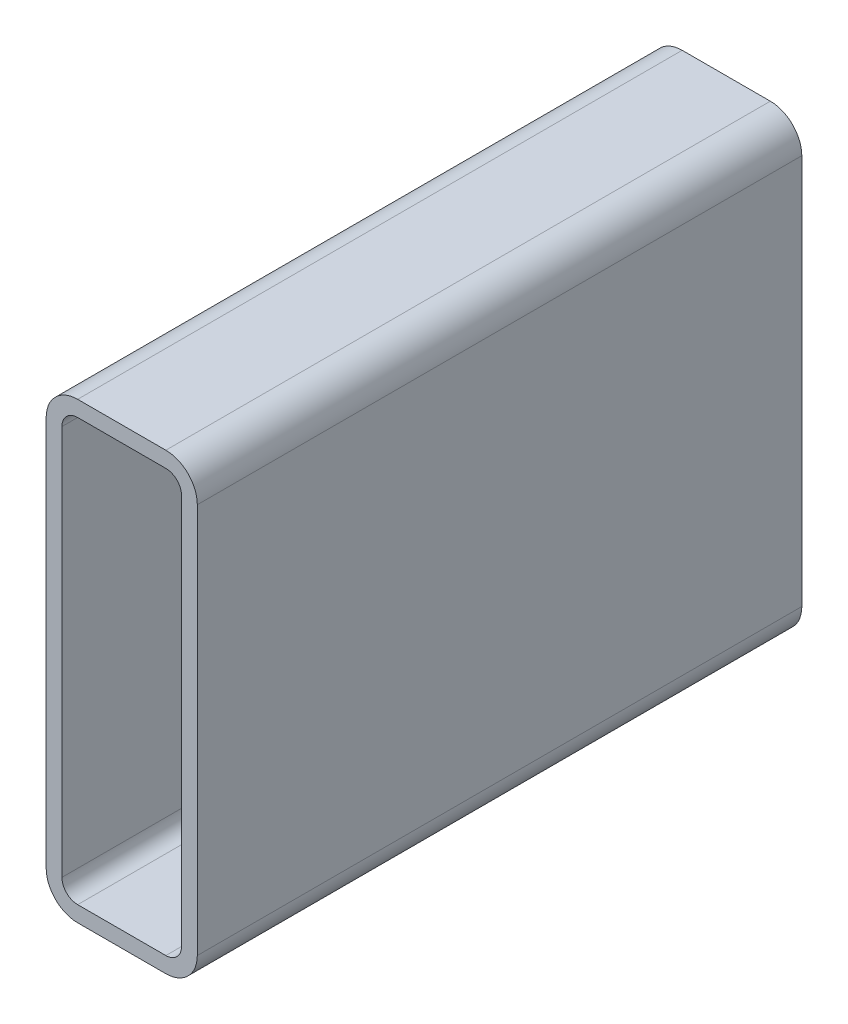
SolidWorks part; units mm, degrees
ref_plane "Front Plane" through (0, 0, 0) normal (0, 0, 1) x (1, 0, 0)
ref_plane "Top Plane" through (0, 0, 0) normal (0, 1, 0) x (1, 0, 0)
ref_plane "Right Plane" through (0, 0, 0) normal (1, 0, 0) x (0, 0, -1)
sketch "Sketch1" plane through (0, 0, 0) normal (0, 0, 1) x (1, 0, 0)
sketch_block_instance "HSS9x3x0.3125-1"
sketch_block "HSS9x3x0.3125"
extrude "Boss-Extrude1" add sketch "Sketch1" along normal blind 304.8
